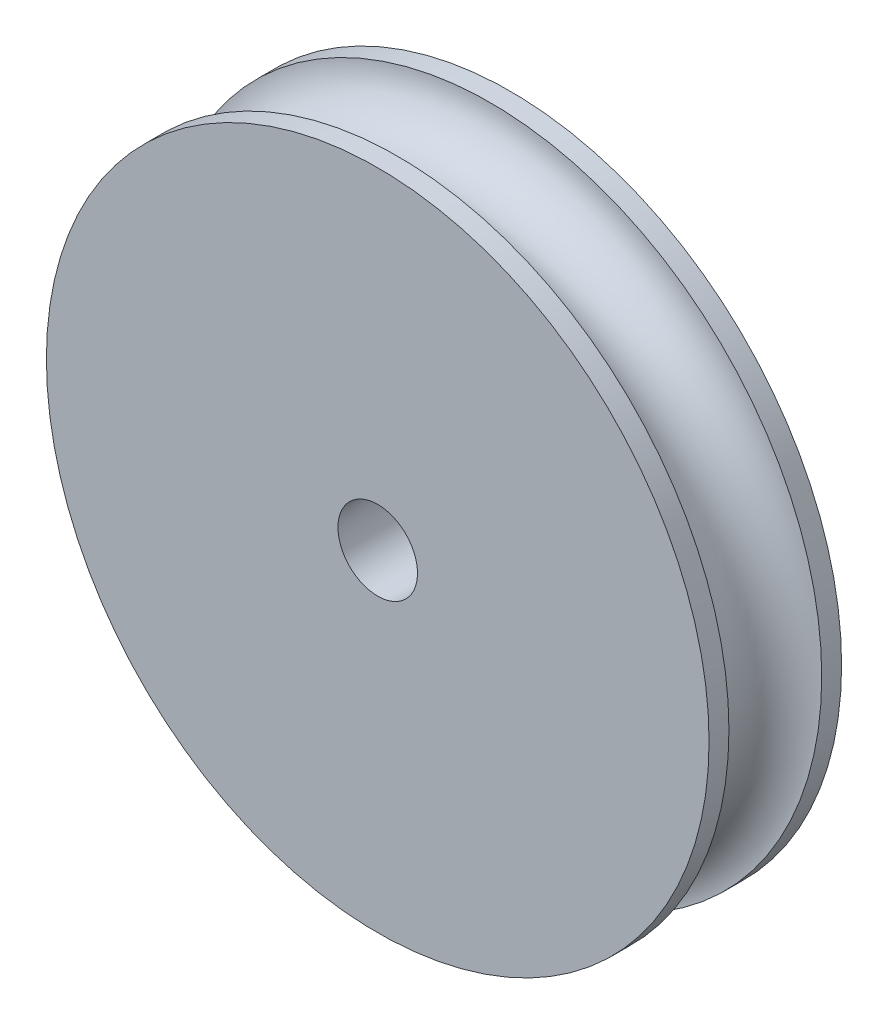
SolidWorks part; units mm, degrees
ref_plane "Front Plane" through (0, 0, 0) normal (0, 0, 1) x (1, 0, 0)
ref_plane "Top Plane" through (0, 0, 0) normal (0, 1, 0) x (1, 0, 0)
ref_plane "Right Plane" through (0, 0, 0) normal (1, 0, 0) x (0, 0, -1)
sketch "Sketch1" plane through (0, 0, 0) normal (0, 0, 1) x (1, 0, 0)
  circle A0 centre (0, 0) radius 12.5
  dimension "D1" = 25
extrude "Boss-Extrude1" add sketch "Sketch1" along normal mid plane 5
sketch "Sketch2" plane through (0, 0, 0) normal (0, 1, 0) x (1, 0, 0)
  line L0 (12.5, 1.75) -> (12.5, -1.75)
  line L1 (0, 2.25) -> (0, -2.25) construction
  line L2 (-12.5, -2.5) -> (12.5, -2.5) construction
  line L3 (12.5, -1.75) -> (12.5, -2.5) construction
  line L4 (12.5, -2.5) -> (12.5, 2.5) construction
  arc A0 (12.5, 1.75) -> (12.5, -1.75) centre (12.5, 0) ccw
  point P5 (0, 0)
  point P12 (0, 0)
  dimension "D1" = 3.5
  dimension "D3" = 2.5
revolve "Cut-Revolve1" cut sketch "Sketch2" angle 360 about L1
sketch "Sketch5" plane through (0, 0, -2.5) normal (0, 0, -1) x (-1, 0, 0)
  circle A1 centre (0, 0) radius 1.5
  dimension "D1" = 3
extrude "Cut-Extrude1" cut sketch "Sketch5" against normal through all
